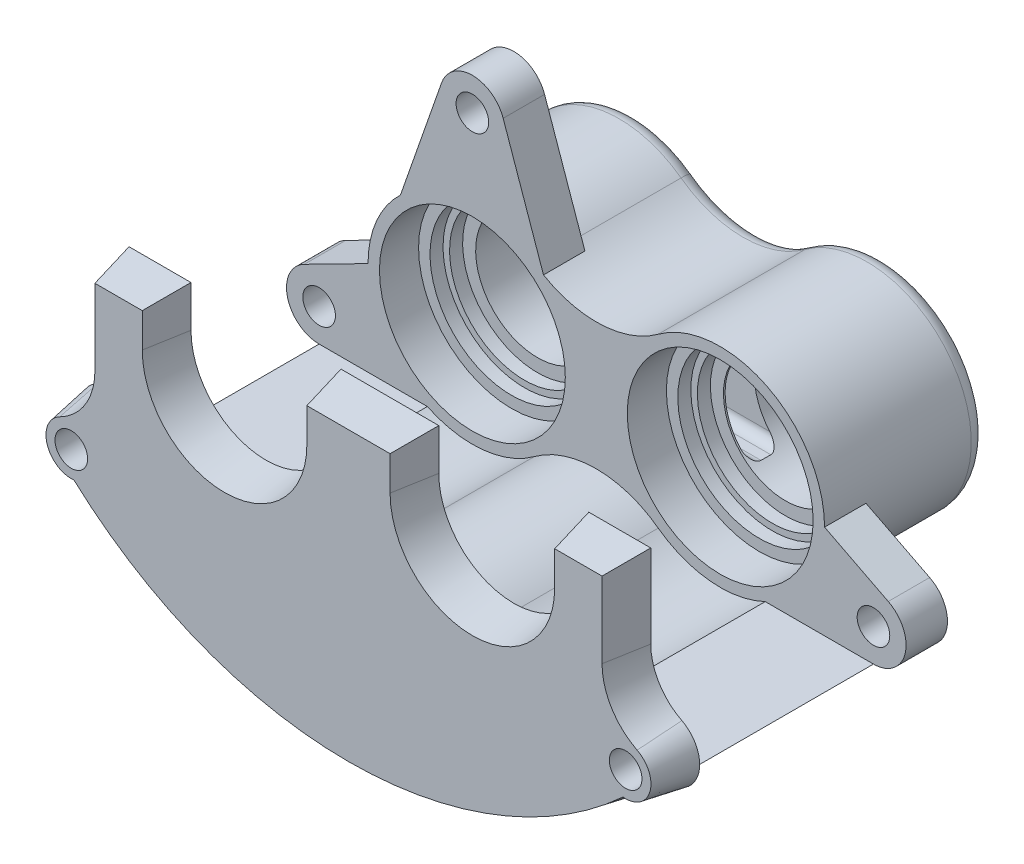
SolidWorks part; units mm, degrees
ref_plane "Front Plane" through (0, 0, 0) normal (0, 0, 1) x (1, 0, 0)
ref_plane "Top Plane" through (0, 0, 0) normal (0, 1, 0) x (1, 0, 0)
ref_plane "Right Plane" through (0, 0, 0) normal (1, 0, 0) x (0, 0, -1)
sketch "Sketch1" plane through (0, 0, 0) normal (0, 0, 1) x (1, 0, 0)
  line L0 (-34.4664, 0) -> (47.957, 0) construction
  line L1 (0, 30.5932) -> (0, -26.7636) construction
  arc A0 (9.5, -12.8732) -> (-9.5, -12.8732) centre (0, -25.7476) ccw
  arc A1 (9.5, -12.8732) -> (9.5, 12.8756) centre (19, 0.0012) ccw
  arc A2 (9.5, 12.8756) -> (-9.5, 12.8756) centre (0, 25.75) cw
  arc A3 (-9.5, 12.8756) -> (-9.5, -12.8732) centre (-19, 0.0012) ccw
  dimension "D1" = 16
  dimension "D2" = 16
  dimension "D3" = 16
  dimension "D4" = 16
  dimension "D5" = 38
  dimension "D6" = 51.4976
  dimension "D7" = 25.75
extrude "Boss-Extrude1" add sketch "Sketch1" along normal mid plane 25 contours A3 A0 A1 A2
ref_plane "Plane1" through (19, 0, 0) normal (1, 0, 0) x (0, 0, -1)
sketch "Sketch2" plane through (19, 0, 0) normal (1, 0, 0) x (0, 0, -1)
  line L0 (-12.5, 0.0012) -> (-12.5, 14.2512)
  line L1 (-12.5, 16.0012) -> (-12.5, -15.9988) construction
  line L2 (-12.5, 14.2512) -> (-6.5, 14.2512)
  line L3 (-6.5, 14.2512) -> (-6.5, 12.5012)
  line L4 (-6.5, 12.5012) -> (-4.5, 12.5012)
  line L5 (-4.5, 12.5012) -> (-4.5, 11.5012)
  line L6 (-4.5, 11.5012) -> (-2.5, 11.5012)
  line L7 (-2.5, 11.5012) -> (-2.5, 9.5012)
  line L8 (-2.5, 9.5012) -> (9.5, 9.5012)
  line L9 (9.5, 9.5012) -> (9.5, 4.5012)
  line L10 (9.5, 4.5012) -> (8.5, 4.5012)
  line L11 (8.5, 4.5012) -> (8.5, 0.0012)
  line L12 (8.5, 0.0012) -> (-12.5, 0.0012)
  point P4 (-2.5, 10.5012)
  point P15 (9, 4.5012)
  dimension "D1" = 14.25
  dimension "D2" = 6
  dimension "D3" = 8
  dimension "D4" = 10
  dimension "D5" = 12.5
  dimension "D6" = 11.5
  dimension "D7" = 9.5
  dimension "D8" = 21
  dimension "D9" = 22
  dimension "D10" = 4.5
revolve "Cut-Revolve1" cut sketch "Sketch2" angle 360 about L12
mirror "Mirror1" about plane through (0, 0, 0) normal (1, 0, 0) of "Cut-Revolve1"
sketch "Sketch3" plane through (0, 0, 0) normal (1, 0, 0) x (0, 0, -1)
  line L1 (-0.75, -7.75) -> (0.75, -7.75)
  line L2 (-2.25, -6.25) -> (-2.25, 6.25)
  line L3 (-0.75, 7.75) -> (0.75, 7.75)
  line L4 (2.25, -6.25) -> (2.25, 6.25)
  line L5 (-2.25, -7.75) -> (2.25, 7.75) construction
  line L6 (-2.25, 7.75) -> (2.25, -7.75) construction
  arc A0 (0.75, -7.75) -> (2.25, -6.25) centre (0.75, -6.25) ccw
  arc A1 (-0.75, -7.75) -> (-2.25, -6.25) centre (-0.75, -6.25) cw
  arc A2 (-2.25, 6.25) -> (-0.75, 7.75) centre (-0.75, 6.25) cw
  arc A3 (0.75, 7.75) -> (2.25, 6.25) centre (0.75, 6.25) cw
  point P0 (0, 0)
  dimension "D3" = 1.5
  dimension "D1" = 4.5
  dimension "D2" = 15.5
extrude "Cut-Extrude1" cut sketch "Sketch3" against normal up to surface and the other way up to surface
sketch "Sketch4" plane through (0, 0, 12.5) normal (0, 0, 1) x (1, 0, 0)
  line L0 (-35, 0.0012) -> (-44.77, -4.9768)
  line L1 (-42.5, -14.4319) -> (-25.9055, -14.4319)
  arc A0 (-9.5, 12.8756) -> (-9.5, -12.8732) centre (-19, 0.0012) ccw construction
  arc A1 (-44.77, -4.9768) -> (-42.5, -14.4319) centre (-42.5, -9.4319) ccw
  circle A2 centre (-19, 0.0012) radius 4.5 construction
  arc A3 (-35, 0.0012) -> (-25.9055, -14.4319) centre (-19, 0.0012) ccw
  dimension "D2" = 5
  dimension "D4" = 16
  dimension "D1" = 27
  dimension "D3" = 23.5
extrude "Boss-Extrude2" add sketch "Sketch4" against normal blind 6.35
mirror "Mirror2" about plane through (0, 0, 0) normal (1, 0, 0) of "Boss-Extrude2"
sketch "Sketch5" plane through (0, 0, 12.5) normal (0, 0, 1) x (1, 0, 0)
  line L0 (-14.2796, 29.6565) -> (-8.096, 11.9494)
  line L1 (-23.7204, 29.6565) -> (-30.0285, 11.5931)
  line L2 (-19, 0.0012) -> (-19, 28.0081) construction
  arc A0 (-9.5, 12.8756) -> (-35, 0.0012) centre (-19, 0.0012) ccw construction
  arc A1 (-14.2796, 29.6565) -> (-23.7204, 29.6565) centre (-19, 28.0081) ccw
  arc A2 (42.5, -14.4319) -> (44.77, -4.9768) centre (42.5, -9.4319) ccw construction
  arc A3 (-9.5, 12.8756) -> (9.5, 12.8756) centre (0, 25.75) ccw construction
  arc A4 (-9.5, 12.8756) -> (-8.096, 11.9494) centre (0, 25.75) ccw
  arc A5 (-9.5, 12.8756) -> (-30.0285, 11.5931) centre (-19, 0.0012) ccw
  circle A6 centre (-19, 28.0081) radius 2.5
  dimension "D1" = 5
  dimension "D5" = 5
  dimension "D4" = 72
  dimension "D2" = 38.5
  dimension "D3" = 19.25
extrude "Boss-Extrude3" add sketch "Sketch5" against normal blind 6.35
sketch "Sketch6" plane through (0, 0, 6.15) normal (0, 0, -1) x (-1, 0, 0)
  line L0 (42.5, -14.4319) -> (25.9055, -14.4319) construction
  line L1 (-42.5, -14.4319) -> (-25.9055, -14.4319) construction
  line L2 (42.5, -14.4319) -> (25.9055, -14.4319)
  line L3 (-42.5, -14.4319) -> (-25.9055, -14.4319)
  arc A0 (42.5, -14.4319) -> (-42.5, -14.4319) centre (0, 32.7486) cw
  arc A1 (9.5, -12.8732) -> (9.5, 12.8756) centre (19, 0.0012) ccw construction
  arc A2 (9.5, -12.8732) -> (-9.5, -12.8732) centre (0, -25.7476) ccw construction
  arc A3 (-9.5, 12.8756) -> (-9.5, -12.8732) centre (-19, 0.0012) ccw construction
  arc A4 (9.5, -12.8732) -> (25.9055, -14.4319) centre (19, 0.0012) ccw
  arc A5 (9.5, -12.8732) -> (-9.5, -12.8732) centre (0, -25.7476) ccw
  arc A6 (-25.9055, -14.4319) -> (-9.5, -12.8732) centre (-19, 0.0012) ccw
  dimension "D1" = 63.5
extrude "Boss-Extrude4" add sketch "Sketch6" against normal blind 38
sketch "Sketch7" plane through (0, 0, 44.15) normal (0, 0, 1) x (1, 0, 0)
  line L10 (40, 2.807) -> (40, 15.5681)
  line L11 (40, 15.5681) -> (30.5, 15.5681)
  line L12 (30.5, 15.5681) -> (30.5, 9.2181)
  line L13 (7.5, 9.2181) -> (7.5, 15.5681)
  line L14 (7.5, 15.5681) -> (-7.5, 15.5681)
  line L15 (0, 0) -> (0, 24.4926) construction
  line L16 (19, 0.0012) -> (19, 25.0242) construction
  line L17 (-7.5, 9.2181) -> (-7.5, 15.5681)
  line L18 (-30.5, 15.5681) -> (-30.5, 9.2181)
  line L19 (-40, 15.5681) -> (-30.5, 15.5681)
  line L20 (-40, 2.807) -> (-40, 15.5681)
  arc A0 (42.5, -14.4319) -> (44.77, -4.9768) centre (42.5, -9.4319) ccw construction
  arc A1 (-42.5, -14.4319) -> (42.5, -14.4319) centre (0, 32.7486) ccw construction
  arc A2 (-44.77, -4.9768) -> (-42.5, -14.4319) centre (-42.5, -9.4319) ccw construction
  arc A3 (42.5, -14.4319) -> (44.77, -4.9768) centre (42.5, -9.4319) ccw
  arc A4 (-42.5, -14.4319) -> (42.5, -14.4319) centre (0, 32.7486) ccw
  arc A5 (-44.77, -4.9768) -> (-42.5, -14.4319) centre (-42.5, -9.4319) ccw
  arc A10 (44.77, -4.9768) -> (40, 2.807) centre (48.736, 2.807) cw
  arc A11 (30.5, 9.2181) -> (7.5, 9.2181) centre (19, 9.2181) cw
  arc A12 (-30.5, 9.2181) -> (-7.5, 9.2181) centre (-19, 9.2181) ccw
  arc A13 (-44.77, -4.9768) -> (-40, 2.807) centre (-48.736, 2.807) ccw
  point P25 (0, 15.5681)
  dimension "D5" = 25
  dimension "D2" = 11.5
  dimension "D1" = 9.5
  dimension "D4" = 6.35
extrude "Boss-Extrude5" add sketch "Sketch7" along normal blind 6.35 draft 10
other "Hole1"
sketch "Sketch8" plane through (0, 0, 50.5) normal (0, 0, 1) x (1, 0, 0)
  circle A0 centre (42.5, -9.4319) radius 2.5
  arc A1 (42.5, -14.4319) -> (44.77, -4.9768) centre (42.5, -9.4319) ccw construction
  dimension "D1" = 5
mirror "Mirror3" about plane through (0, 0, 0) normal (1, 0, 0) of "Hole1"
fillet "Fillet1" radius 2.5 4 edges at (0, -9.7476, -12.5) (-35, 0.0012, -12.5) (0, 9.75, -12.5) (35, 0.0012, -12.5)
